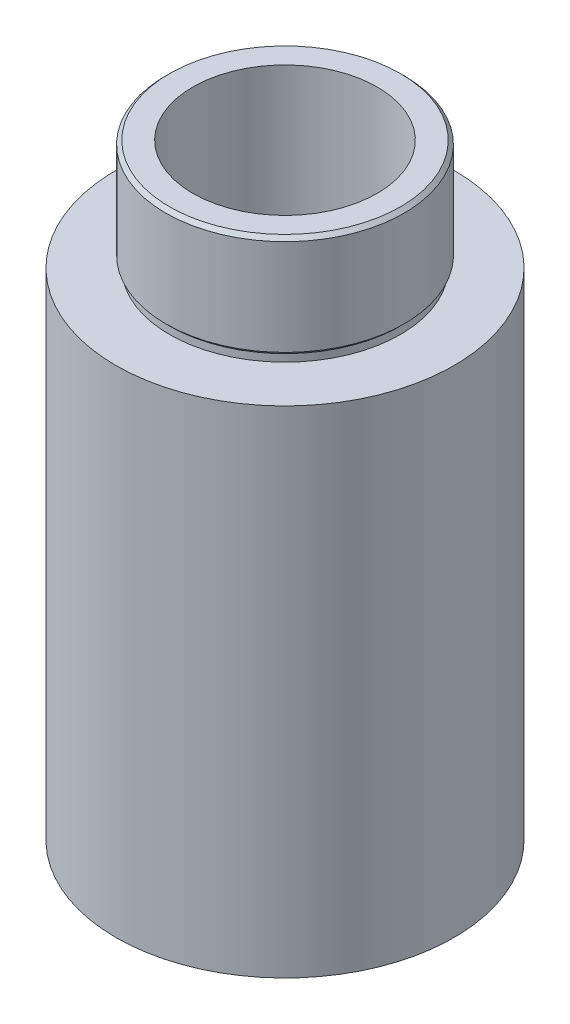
SolidWorks part; units mm, degrees
ref_plane "Front Plane" through (0, 0, 0) normal (0, 0, 1) x (1, 0, 0)
ref_plane "Top Plane" through (0, 0, 0) normal (0, 1, 0) x (1, 0, 0)
ref_plane "Right Plane" through (0, 0, 0) normal (1, 0, 0) x (0, 0, -1)
imported_body "Defeatured1"
sketch "Sketch1" plane through (0, 222.2255, 0) normal (0, -1, 0) x (1, 0, 0)
  circle A0 centre (41.6649, 0) radius 14.0716
extrude "Cut-Extrude1" cut sketch "Sketch1" against normal up to surface (0.0254 mm away)
sketch "Sketch2" plane through (0, 228.7263, 0) normal (0, -1, 0) x (1, 0, 0)
  circle A0 centre (41.6649, 0) radius 10.795
extrude "Cut-Extrude2" cut sketch "Sketch2" against normal up to surface (40.7114 mm away)
